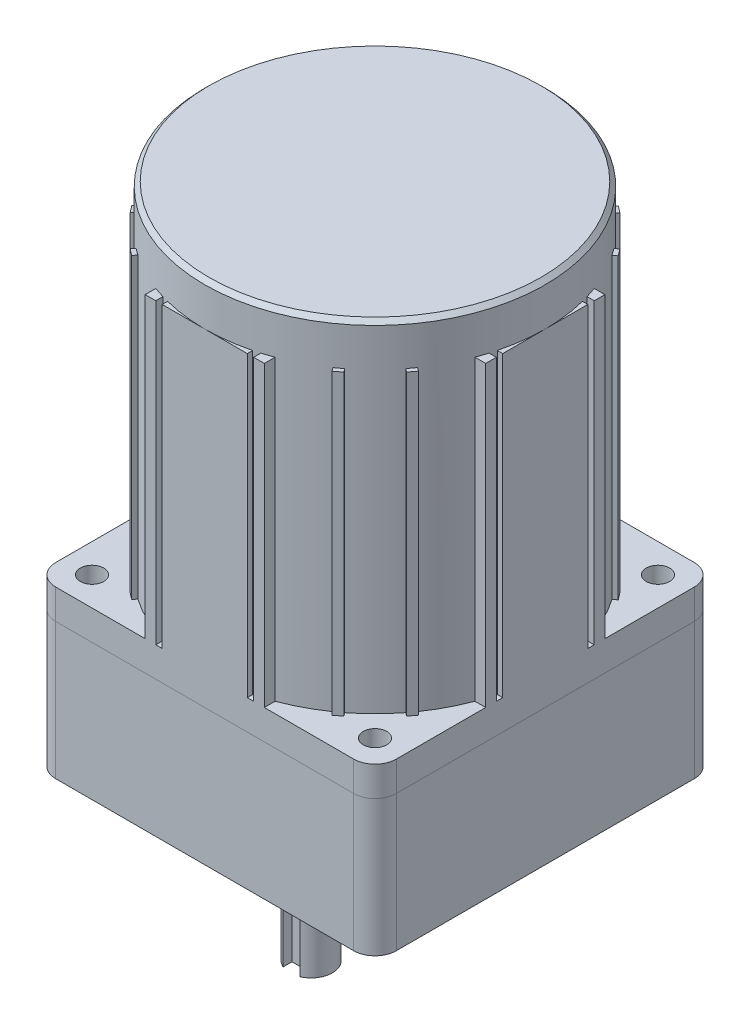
SolidWorks part; units mm, degrees
ref_plane "Front Plane" through (0, 0, 0) normal (0, 0, 1) x (1, 0, 0)
ref_plane "Top Plane" through (0, 0, 0) normal (0, 1, 0) x (1, 0, 0)
ref_plane "Right Plane" through (0, 0, 0) normal (1, 0, 0) x (0, 0, -1)
sketch "Sketch1" plane through (0, 0, 0) normal (0, 1, 0) x (1, 0, 0)
  line L1 (0, 0) -> (80, 0)
  line L2 (0, 0) -> (0, -80)
  line L3 (0, -80) -> (80, -80)
  line L4 (80, 0) -> (80, -80)
  dimension "D1" = 80
  dimension "D2" = 80
extrude "Boss-Extrude1" add sketch "Sketch1" along normal blind 87
sketch "Sketch2" plane through (0, 87, 0) normal (0, 1, 0) x (1, 0, 0)
  line L0 (40, 0) -> (40, -80) construction
  line L1 (80, 0) -> (0, 0) construction
  line L2 (0, -80) -> (80, -80) construction
  line L3 (40, -80) -> (0, -40) construction
  line L4 (0, 0) -> (0, -80) construction
  line L5 (0, -40) -> (80, -40) construction
  line L6 (80, -80) -> (80, 0) construction
  circle A0 centre (40, -40) radius 40
  dimension "D1" = 80
extrude "Cut-Extrude1" cut sketch "Sketch2" against normal blind 10 flip side to cut
sketch "Sketch4" plane through (0, 0, 0) normal (0, -1, 0) x (1, 0, 0)
  line L0 (80, 0) -> (0, 0) construction
  line L1 (80, 80) -> (80, 0) construction
  line L2 (40, 0) -> (40, 80) construction
  line L3 (0, 80) -> (80, 80) construction
  line L4 (40, 80) -> (80, 40) construction
  line L5 (80, 40) -> (0, 40) construction
  line L6 (0, 0) -> (0, 80) construction
  line L7 (40, 40) -> (64.7487, 15.2513) construction
  line L8 (40, 40) -> (94.5399, 40) construction
  circle A5 centre (40, 40) radius 35 construction
  circle A6 centre (64.7487, 15.2513) radius 2.25
  circle A7 centre (15.2513, 15.2513) radius 2.25
  circle A8 centre (15.2513, 64.7487) radius 2.25
  circle A9 centre (64.7487, 64.7487) radius 2.25
  dimension "D1" = 70
  dimension "D2" = 4.5
  dimension "D3" = 45
extrude "Cut-Extrude2" cut sketch "Sketch4" against normal blind 20
sketch "Sketch5" plane through (0, 0, 0) normal (0, -1, 0) x (-1, 0, 0)
  line L1 (0, -80) -> (-80, -80)
  line L2 (0, -80) -> (0, 0)
  line L3 (0, 0) -> (-80, 0)
  line L4 (-80, -80) -> (-80, 0)
extrude "Boss-Extrude2" add sketch "Sketch5" along normal blind 32 separate body
sketch "Sketch6" plane through (0, -32, 0) normal (0, -1, 0) x (1, 0, 0)
  line L0 (0, 40) -> (80, 40) construction
  line L1 (0, 80) -> (0, 0) construction
  line L2 (80, 0) -> (80, 80) construction
  line L3 (40, 40) -> (-22.9854, 40) construction
  line L4 (80, 80) -> (0, 80) construction
  line L5 (40, 80) -> (40, 0) construction
  line L6 (0, 0) -> (80, 0) construction
  line L7 (40, 40) -> (6.766, 73.234) construction
  circle A11 centre (40, 40) radius 47 construction
  circle A12 centre (6.766, 73.234) radius 2.75
  circle A13 centre (6.766, 6.766) radius 2.75
  circle A14 centre (73.234, 73.234) radius 2.75
  circle A15 centre (73.234, 6.766) radius 2.75
  dimension "D1" = 94
  dimension "D2" = 5.5
  dimension "D3" = 45
extrude "Cut-Extrude3" cut sketch "Sketch6" against normal through all
sketch "Sketch7" plane through (0, -32, 0) normal (0, -1, 0) x (1, 0, 0)
  circle A0 centre (40, 40) radius 36.5
  dimension "D3" = 73
  dimension "D1" = 40
  dimension "D2" = 40
extrude "Cut-Extrude4" cut sketch "Sketch7" against normal blind 2
sketch "Sketch8" plane through (0, -30, 0) normal (0, -1, 0) x (1, 0, 0)
  line L0 (80, 0) -> (80, 80) construction
  line L2 (0, 40) -> (80, 40) construction
  circle A0 centre (40, 55) radius 17
  circle A1 centre (40, 40) radius 36.5 construction
  dimension "D3" = 34
  dimension "D1" = 15
  dimension "D2" = 40
extrude "Boss-Extrude3" add sketch "Sketch8" along normal blind 5
sketch "Sketch9" plane through (0, -35, 0) normal (0, -1, 0) x (-1, 0, 0)
  circle A0 centre (-40, -55) radius 5
  dimension "D1" = 10
extrude "Boss-Extrude4" add sketch "Sketch9" along normal blind 29
sketch "Sketch10" plane through (0, -64, 0) normal (0, -1, 0) x (-1, 0, 0)
  line L6 (0, -80) -> (0, 0) construction
  line L7 (-38, -61.5) -> (-42, -61.5)
  line L8 (-38, -61.5) -> (-38, -57.5)
  line L9 (-38, -57.5) -> (-42, -57.5)
  line L10 (-42, -61.5) -> (-42, -57.5)
  circle A0 centre (-40, -55) radius 5 construction
  circle A1 centre (-40, -55) radius 5 construction
  point P0 (-35, -55)
  point P1 (-40, -60)
  point P11 (-38, -59.5)
  dimension "D1" = 2.5
  dimension "D2" = 4
  dimension "D3" = 38
  dimension "D4" = 4
  dimension "D5" = 60
extrude "Cut-Extrude5" [suppressed] cut sketch "Sketch10" against normal blind 25
fillet "Fillet1" radius 5 4 edges at (80, -16, 0) (0, -16, 0) (0, -16, 80) (80, -16, 80)
chamfer "Chamfer1" distance 1 angle 45 1 edges at (40, 87, 80)
sketch "Sketch11" plane through (0, 77, 0) normal (0, 1, 0) x (1, 0, 0)
  line L0 (0, -40) -> (0, -30)
  line L1 (0, 0) -> (0, -40) construction
  line L2 (0, -30) -> (1.2702, -30)
  line L3 (1.6888, -28.5) -> (0, -28.5)
  line L4 (0, -28.5) -> (0, -26)
  line L5 (0, -26) -> (2.53, -26)
  line L6 (40, 0) -> (30, 0)
  line L7 (30, 0) -> (30, -1.2702)
  line L8 (28.5, -1.6888) -> (28.5, 0)
  line L9 (40, 0) -> (0, 0) construction
  line L10 (28.5, 0) -> (26, 0)
  line L11 (26, 0) -> (26, -2.53)
  line L12 (8.3261, -15.5712) -> (7.5343, -14.9605)
  line L13 (7.5343, -14.9605) -> (6.3128, -16.5442)
  line L14 (6.3128, -16.5442) -> (7.1735, -17.1435)
  line L15 (15.5072, -8.3756) -> (14.8948, -7.585)
  line L16 (14.8948, -7.585) -> (16.476, -6.3604)
  line L17 (16.476, -6.3604) -> (17.0771, -7.2198)
  circle A0 centre (40, -40) radius 40 construction
  circle A1 centre (40, -40) radius 40 construction
  circle A2 centre (40, -40) radius 40
  dimension "D1" = 10
  dimension "D2" = 1.5
  dimension "D3" = 2.5
  dimension "D4" = 10
  dimension "D5" = 1.5
  dimension "D6" = 2.5
  dimension "D7" = 1
  dimension "D8" = 1
  dimension "D9" = 10
  dimension "D10" = 2
  dimension "D11" = 2
  dimension "D12" = 10
extrude "Cut-Extrude6" cut sketch "Sketch11" against normal offset from surface (70 mm away) 7 contours L16 L17 L11 L5 L14 L13 L12 L15 M7 M8 M6 | L3 L2 M7 M6 | L8 L7 M7 M8
ref_plane "Plane1" through (40, 0, 0) normal (1, 0, 0) x (0, 0, -1)
mirror "Mirror1" about plane through (40, 0, 0) normal (1, 0, 0) of "Cut-Extrude6"
ref_plane "Plane2" through (0, 0, 40) normal (0, 0, -1) x (-1, 0, 0)
mirror "Mirror3" about plane through (0, 0, 40) normal (0, 0, -1) of "Mirror1", "Cut-Extrude6"
fillet "Fillet3" radius 5 4 edges at (80, 3.5, 0) (0, 3.5, 0) (0, 3.5, 80) (80, 3.5, 80)
ref_plane "Plane3" through (0, 0, 60) normal (0, 0, 1) x (1, 0, 0)
sketch "Sketch12" plane through (0, 0, 60) normal (0, 0, 1) x (1, 0, 0)
  line L0 (40, -64) -> (40, -41) construction
  line L1 (35, -64) -> (45, -64) construction
  line L2 (38, -64) -> (38, -41)
  line L3 (42, -64) -> (42, -41)
  arc A0 (38, -64) -> (42, -64) centre (40, -64) ccw
  arc A1 (42, -41) -> (38, -41) centre (40, -41) ccw
  point P4 (40, -52.5)
  dimension "D1" = 4
  dimension "D2" = 23
extrude "Cut-Extrude7" cut sketch "Sketch12" against normal blind 2.5
